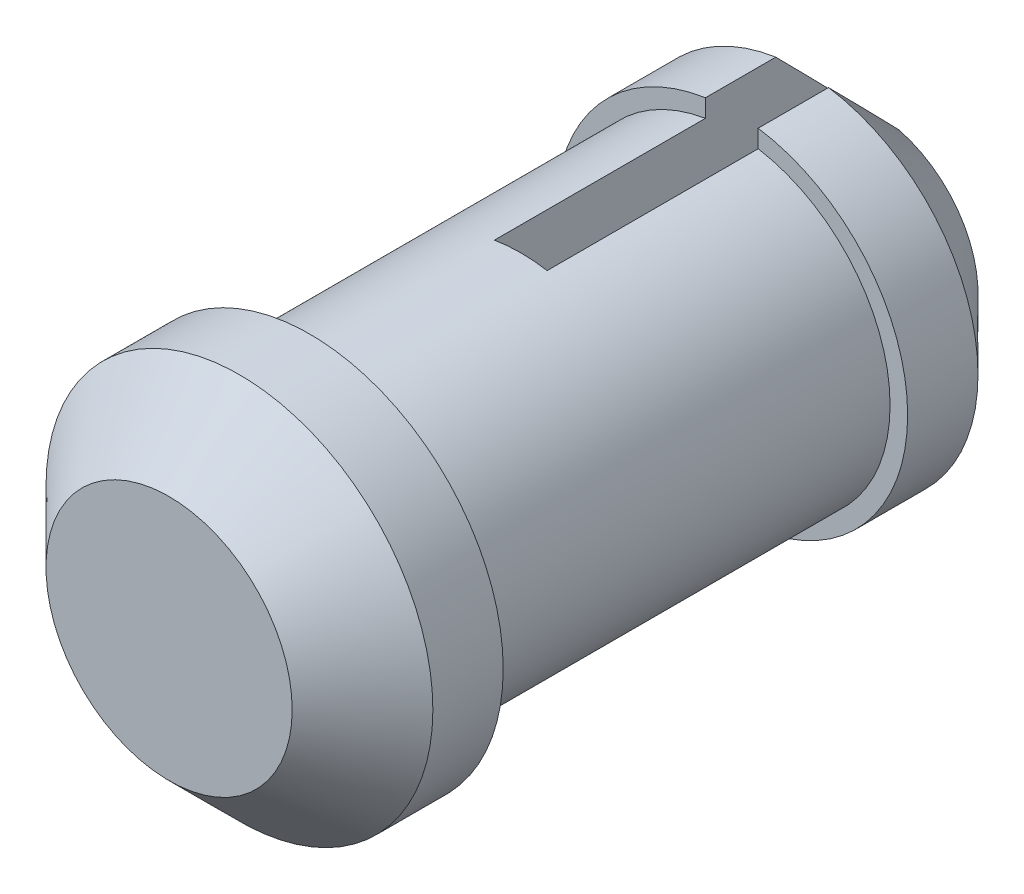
SolidWorks part; units mm, degrees
ref_plane "Alzado" through (0, 0, 0) normal (0, 0, 1) x (1, 0, 0)
ref_plane "Planta" through (0, 0, 0) normal (0, 1, 0) x (1, 0, 0)
ref_plane "Vista lateral" through (0, 0, 0) normal (1, 0, 0) x (0, 0, -1)
sketch "Croquis1" plane through (0, 0, 0) normal (0, 0, 1) x (1, 0, 0)
  circle A0 centre (0, 0) radius 4.5
  dimension "D1" = 9
extrude "Saliente-Extruir1" add sketch "Croquis1" along normal blind 12
sketch "Croquis2" plane through (0, 0, 0) normal (0, 0, -1) x (-1, 0, 0)
  circle A1 centre (0, 0) radius 5
  dimension "D1" = 10
extrude "Saliente-Extruir2" add sketch "Croquis2" along normal blind 4
sketch "Croquis3" plane through (0, 0, 12) normal (0, 0, 1) x (1, 0, 0)
  circle A0 centre (0, 0) radius 5.5
  dimension "D1" = 11
extrude "Saliente-Extruir3" add sketch "Croquis3" along normal blind 4
sketch "Croquis4" plane through (0, 0, -4) normal (0, 0, -1) x (-1, 0, 0)
  line L1 (-0.75, 5.3036) -> (0.75, 5.3036)
  line L2 (-0.75, 5.3036) -> (-0.75, -5.2722)
  line L3 (-0.75, -5.2722) -> (0.75, -5.2722)
  line L4 (0.75, 5.3036) -> (0.75, -5.2722)
  point P4 (0, -5.2722)
  dimension "D1" = 1.5
extrude "Cortar-Extruir1" cut sketch "Croquis4" against normal blind 10
chamfer "Chaflán1" distance 2 angle 45 3 edges at (5.5, 0, 16) (-5, 0, -4) (5, 0, -4)
